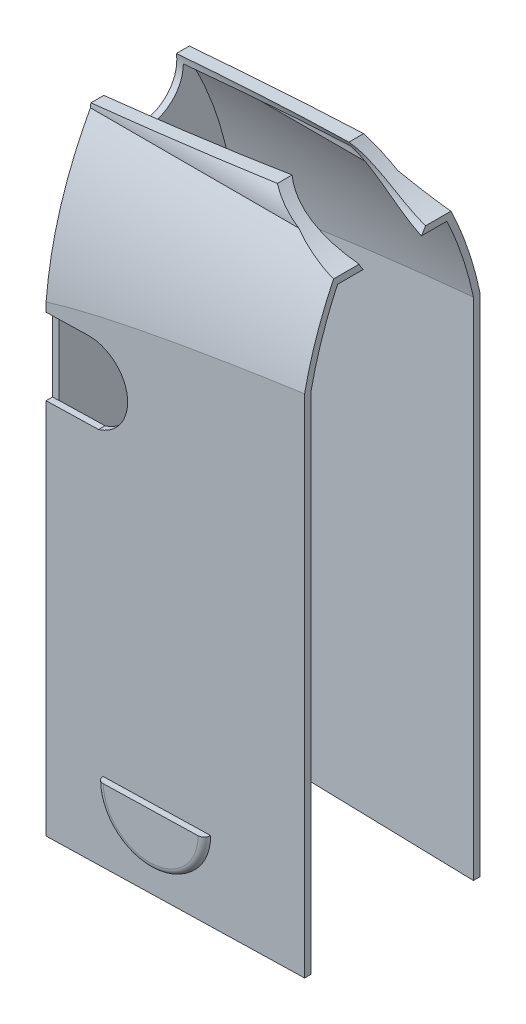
SolidWorks part; units mm, degrees
ref_plane "Front Plane" through (0, 0, 0) normal (0, 0, 1) x (1, 0, 0)
ref_plane "Top Plane" through (0, 0, 0) normal (0, 1, 0) x (1, 0, 0)
ref_plane "Right Plane" through (0, 0, 0) normal (1, 0, 0) x (0, 0, -1)
sketch "Sketch1" plane through (0, 0, 0) normal (0, 0, 1) x (1, 0, 0)
  line L0 (0, 0) -> (0, 73.406)
  line L1 (0, 73.406) -> (20.7572, 75.4047)
  line L2 (0, 0) -> (30.9626, 0)
  line L3 (0, 73.406) -> (56.4166, 73.406) construction
  line L4 (30.9626, 0) -> (30.9626, 69.1551)
  arc A0 (20.7572, 75.4047) -> (29.7233, 70.6938) centre (33.782, 89.3064) ccw
  arc A1 (30.9626, 69.1551) -> (29.7233, 70.6938) centre (29.3878, 69.1551) ccw
  point P3 (33.782, 89.3064)
  point P14 (30.9626, 0)
  dimension "D6" = 38.1
  dimension "D7" = 1.5748
  dimension "D1" = 73.406
  dimension "D2" = 30.9626
  dimension "D3" = 5.5
  dimension "D4" = 89.3064
  dimension "D5" = 33.782
extrude "Boss-Extrude1" add sketch "Sketch1" against normal blind 10.5664
sketch "Sketch12" plane through (0, 0, 0) normal (0, 1, 0) x (1, 0, 0)
  line L0 (0, 10.5664) -> (30.9662, 9.788)
  line L2 (32.4796, 10.5664) -> (0, 10.5664)
  line L3 (30.9662, 9.788) -> (32.4796, 9.7499)
  line L4 (32.4796, 10.5664) -> (32.4796, 9.7499)
  dimension "D1" = 1.44
extrude "Cut-Extrude14" cut sketch "Sketch12" against normal through all and the other way through all
sketch "Sketch2" plane through (0, 0, 0) normal (-1, 0, 0) x (0, 0, 1)
  line L3 (0, 0) -> (0, 103.7085) construction
  circle A0 centre (0, 73.406) radius 4.445
  point P5 (0, 73.406)
  point P9 (0, 68.961)
  dimension "D1" = 8.89
  dimension "D2" = 68.961
extrude "Cut-Extrude2" cut sketch "Sketch2" against normal through all
sketch "Sketch3" plane through (0, 0, 0) normal (-1, 0, 0) x (0, 0, 1)
  line L0 (-10.0446, 75.4047) -> (-3.9703, 75.4047) construction
  line L2 (-10.5918, 55.88) -> (-25.1156, 55.88)
  line L3 (-25.1156, 55.88) -> (-25.1156, 92.4891)
  line L4 (-25.1156, 92.4891) -> (-4.7577, 92.4891)
  line L5 (-4.7577, 92.4891) -> (-4.7577, 75.4047)
  line L6 (-10.5664, 73.406) -> (-4.445, 73.406) construction
  arc A1 (-4.7577, 75.4047) -> (-5.2324, 73.406) centre (-0.0489, 73.2306) ccw
  spline S0 degree 2 poles (-10.5918, 55.88) (-9.7947, 65.1395) (-5.2324, 73.406) knots 0 0 0 1 1 1
  dimension "D2" = 55.88
  dimension "D1" = 0.7874
  dimension "D3" = 0.7874
extrude "Cut-Extrude4" cut sketch "Sketch3" against normal through all
shell "Shell3" thickness 0.7874
ref_plane "Plane1" through (0, 0, 0) normal (0, 0, 1) x (1, 0, 0)
mirror "Mirror1" about plane through (0, 0, 0) normal (0, 0, 1)
sketch "Sketch4" plane through (-0.7874, 0, 0) normal (-1, 0, 0) x (0, 0, 1)
  line L0 (0, 0) -> (0, 88.2846) construction
  line L1 (3.175, 33.655) -> (-3.175, 33.655)
  line L2 (-3.175, 33.655) -> (-3.175, 18.415)
  line L3 (-3.175, 18.415) -> (3.175, 18.415)
  line L4 (3.175, 33.655) -> (3.175, 18.415)
  line L5 (-11.3738, 0) -> (11.3738, 0) construction
  line L6 (-7.493, 0) -> (-7.493, 94.9464) construction
  circle A0 centre (-7.493, 16.891) radius 1.9812
  point P8 (0, 18.415)
  point P9 (0, 33.655)
  dimension "D5" = 3.9624
  dimension "D1" = 6.35
  dimension "D2" = 15.24
  dimension "D3" = 18.415
  dimension "D4" = 7.493
  dimension "D6" = 16.891
extrude "Cut-Extrude5" cut sketch "Sketch4" against normal up to next
sketch "Sketch9" plane through (0, 0, 0) normal (0, 1, 0) x (1, 0, 0)
  line L1 (30.9626, 13.6292) -> (33.2431, 13.6292)
  line L2 (33.2431, 13.6292) -> (33.2431, -15.5315)
  line L3 (33.2431, -15.5315) -> (30.9626, -15.5315)
  line L5 (29.7233, -3.5216) -> (29.7233, -15.5315)
  line L6 (29.7233, -15.5315) -> (30.9626, -15.5315)
  line L7 (29.7233, -3.5216) -> (29.7233, 13.6292)
  line L8 (29.7233, 13.6292) -> (30.9626, 13.6292)
extrude "Cut-Extrude12" cut sketch "Sketch9" along normal through all
ref_plane "Plane2" through (0, 0, 11.3738) normal (0, 0, 1) x (0, -1, 0)
sketch "Sketch14" plane through (0, 0, 11.3738) normal (0, 0, 1) x (0, -1, 0)
  line L0 (-54.8907, 4.1148) -> (-54.8907, 0)
  line L1 (-55.976, -0.7874) -> (0, -0.7874) construction
  line L2 (-54.8907, 0) -> (-45.6197, 0)
  line L3 (-45.6197, 0) -> (-45.6197, 5.4078)
  arc A1 (-54.8907, 4.1148) -> (-45.6197, 5.4078) centre (-50.165, 4.1148) cw
  point P0 (-50.165, 4.1148)
  dimension "D1" = 50.165
  dimension "D2" = 4.9022
  dimension "D3" = 0.7874
  dimension "D4" = 9.271
extrude "Cut-Extrude15" cut sketch "Sketch14" against normal up to next
sketch "Sketch15" plane through (0, 0, 11.3738) normal (0, 0, 1) x (0, -1, 0)
  line L0 (-54.8907, 0) -> (-54.8907, -0.7874)
  line L1 (-55.976, -0.7874) -> (0, -0.7874) construction
  line L2 (-54.8907, -0.7874) -> (-45.6197, -0.7874)
  line L3 (-45.6197, -0.7874) -> (-45.6197, 0)
  line L4 (-45.6197, 0) -> (-54.8907, 0)
extrude "Cut-Extrude16" cut sketch "Sketch15" against normal blind 0.7874
ref_plane "Plane6" through (0.2852, 0, 11.3469) normal (0.0251, 0, 0.9997) x (0.9997, 0, -0.0251)
sketch "Sketch20" plane through (0.2852, 0, 11.3469) normal (0.0251, 0, 0.9997) x (0.9997, 0, -0.0251)
  line L0 (-1.073, 45.6197) -> (-1.073, 0) construction
  line L1 (29.4474, 0) -> (-1.073, 0) construction
  line L2 (5.658, 9.525) -> (18.358, 9.525)
  arc A0 (5.658, 9.525) -> (18.358, 9.525) centre (12.008, 9.525) ccw
  point P0 (12.008, 9.525)
  dimension "D3" = 12.7
  dimension "D1" = 13.081
  dimension "D2" = 9.525
extrude "Boss-Extrude6" add sketch "Sketch20" along normal blind 0.762
fillet "Fillet4" radius 0.762 1 edges at (12.3086, 3.175, 11.8069)
ref_plane "Plane8" through (0.2852, 0, -11.3469) normal (0.0251, 0, -0.9997) x (-0.9997, 0, -0.0251)
sketch "Sketch23" plane through (0.2852, 0, -11.3469) normal (0.0251, 0, -0.9997) x (-0.9997, 0, -0.0251)
  line L0 (1.073, 55.976) -> (1.073, 0) construction
  line L1 (-29.4474, 0) -> (1.073, 0) construction
  line L2 (-18.358, 9.525) -> (-5.658, 9.525)
  arc A0 (-18.358, 9.525) -> (-5.658, 9.525) centre (-12.008, 9.525) ccw
  point P0 (-12.008, 9.525)
  dimension "D3" = 12.7
  dimension "D1" = 13.081
  dimension "D2" = 9.525
extrude "Boss-Extrude7" add sketch "Sketch23" along normal blind 0.762
fillet "Fillet5" radius 0.762 1 edges at (12.3086, 3.175, -11.8069)
sketch "Sketch24" plane through (0, 0, 0) normal (0, -1, 0) x (1, 0, 0)
  line L0 (-0.7874, 11.3738) -> (29.7233, 10.6069) construction
  line L1 (29.7233, 10.6069) -> (39.6123, 10.3583) construction
  line L2 (0, 0) -> (46.0071, 0) construction
  line L3 (-0.7874, -11.3738) -> (29.7233, -10.6069) construction
  line L4 (29.7233, -10.6069) -> (43.0263, -10.2725) construction
  dimension "D1" = 1.44
  dimension "D2" = 1.44
